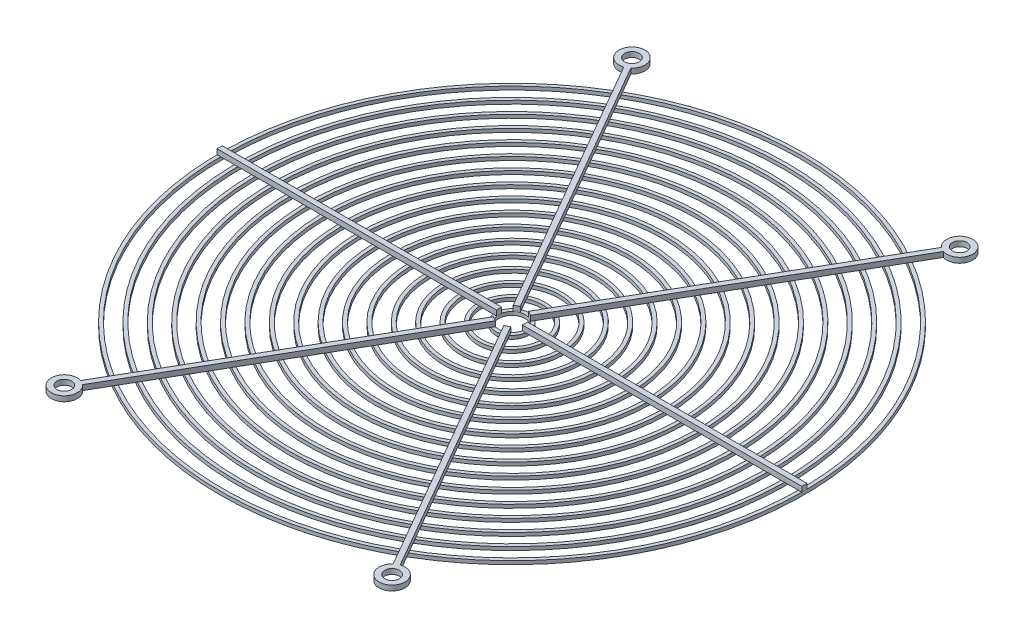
SolidWorks part; units mm, degrees
ref_plane "Plan de face" through (0, 0, 0) normal (0, 0, 1) x (1, 0, 0)
ref_plane "Plan de dessus" through (0, 0, 0) normal (0, 1, 0) x (1, 0, 0)
ref_plane "Plan de droite" through (0, 0, 0) normal (1, 0, 0) x (0, 0, -1)
ref_plane "Plan1" through (0, 2, 0) normal (0, 1, 0) x (-1, 0, 0)
sketch "Esquisse1" plane through (0, 0, 0) normal (0, 0, 1) x (1, 0, 0)
  line L0 (0, 0) -> (0, 38.6522) construction
  line L1 (19.5, 0) -> (19.5, 2)
  line L2 (7.5, 0) -> (9.5, 0)
  line L3 (7.5, 0) -> (7.5, 2)
  line L4 (7.5, 2) -> (9.5, 2)
  line L5 (9.5, 0) -> (9.5, 2)
  line L6 (17.5, 0) -> (19.5, 0)
  line L7 (17.5, 2) -> (19.5, 2)
  line L8 (17.5, 0) -> (17.5, 2)
  line L9 (29.5, 0) -> (29.5, 2)
  line L10 (27.5, 0) -> (29.5, 0)
  line L11 (27.5, 2) -> (29.5, 2)
  line L12 (27.5, 0) -> (27.5, 2)
  line L13 (39.5, 0) -> (39.5, 2)
  line L14 (37.5, 0) -> (39.5, 0)
  line L15 (37.5, 2) -> (39.5, 2)
  line L16 (37.5, 0) -> (37.5, 2)
  line L17 (49.5, 0) -> (49.5, 2)
  line L18 (47.5, 0) -> (49.5, 0)
  line L19 (47.5, 2) -> (49.5, 2)
  line L20 (47.5, 0) -> (47.5, 2)
  line L21 (59.5, 0) -> (59.5, 2)
  line L22 (57.5, 0) -> (59.5, 0)
  line L23 (57.5, 2) -> (59.5, 2)
  line L24 (57.5, 0) -> (57.5, 2)
  line L25 (69.5, 0) -> (69.5, 2)
  line L26 (67.5, 0) -> (69.5, 0)
  line L27 (67.5, 2) -> (69.5, 2)
  line L28 (67.5, 0) -> (67.5, 2)
  line L29 (79.5, 0) -> (79.5, 2)
  line L30 (77.5, 0) -> (79.5, 0)
  line L31 (77.5, 2) -> (79.5, 2)
  line L32 (77.5, 0) -> (77.5, 2)
  line L33 (89.5, 0) -> (89.5, 2)
  line L34 (87.5, 0) -> (89.5, 0)
  line L35 (87.5, 2) -> (89.5, 2)
  line L36 (87.5, 0) -> (87.5, 2)
  line L37 (99.5, 0) -> (99.5, 2)
  line L38 (97.5, 0) -> (99.5, 0)
  line L39 (97.5, 2) -> (99.5, 2)
  line L40 (97.5, 0) -> (97.5, 2)
  line L41 (109.5, 0) -> (109.5, 2)
  line L42 (107.5, 0) -> (109.5, 0)
  line L43 (107.5, 2) -> (109.5, 2)
  line L44 (107.5, 0) -> (107.5, 2)
  line L45 (119.5, 0) -> (119.5, 2)
  line L46 (117.5, 0) -> (119.5, 0)
  line L47 (117.5, 2) -> (119.5, 2)
  line L48 (117.5, 0) -> (117.5, 2)
  line L49 (129.5, 0) -> (129.5, 2)
  line L50 (127.5, 0) -> (129.5, 0)
  line L51 (127.5, 2) -> (129.5, 2)
  line L52 (127.5, 0) -> (127.5, 2)
  line L53 (139.5, 0) -> (139.5, 2)
  line L54 (137.5, 0) -> (139.5, 0)
  line L55 (137.5, 2) -> (139.5, 2)
  line L56 (137.5, 0) -> (137.5, 2)
  line L57 (149.5, 0) -> (149.5, 2)
  line L58 (147.5, 0) -> (149.5, 0)
  line L59 (147.5, 2) -> (149.5, 2)
  line L60 (147.5, 0) -> (147.5, 2)
  line L61 (159.5, 0) -> (159.5, 2)
  line L62 (157.5, 0) -> (159.5, 0)
  line L63 (157.5, 2) -> (159.5, 2)
  line L64 (157.5, 0) -> (157.5, 2)
  line L65 (169.5, 0) -> (169.5, 2)
  line L66 (167.5, 0) -> (169.5, 0)
  line L67 (167.5, 2) -> (169.5, 2)
  line L68 (167.5, 0) -> (167.5, 2)
  dimension "D2" = 2
  dimension "D3" = 2
revolve "Révolution1" add sketch "Esquisse1" angle 360 about L0
sketch "Esquisse2" plane through (0, 2, 0) normal (0, 1, 0) x (1, 0, 0)
  line L1 (7.5, 1.5) -> (182.6515, 1.5)
  line L2 (7.5, 1.5) -> (7.5, -1.5)
  line L3 (7.5, -1.5) -> (182.6515, -1.5)
  arc A0 (182.6515, -1.5) -> (182.6515, 1.5) centre (190, 0) ccw
  circle A1 centre (190, 0) radius 4.25
  dimension "D4" = 3
  dimension "D2" = 7.5
  dimension "D5" = 190
  dimension "D1" = 8.5
  dimension "D3" = 7.5
  dimension "D6" = 1.5
extrude "Extrusion2" add sketch "Esquisse2" along normal blind 3 separate body
pattern_circular "Répétition circulaire2" count 6 over 360 about axis through (0, 0, 0) along (0, 1, 0)
sketch "Esquisse4" plane through (0, 2, 0) normal (0, -1, 0) x (1, 0, 0)
  line L1 (169.5, 1.5) -> (169.5, -1.5)
  line L3 (-7.5, -1.5) -> (-7.5, 1.5)
  line L4 (-7.5, 1.5) -> (-182.6515, 1.5)
  line L5 (-182.6515, -1.5) -> (-7.5, -1.5)
  line L6 (7.5, 1.5) -> (7.5, -1.5)
  line L7 (-169.4934, 1.5) -> (-182.6515, 1.5)
  line L8 (-182.6515, -1.5) -> (-169.4934, -1.5)
  line L9 (7.5, -1.5) -> (182.6515, -1.5)
  line L10 (182.6515, 1.5) -> (7.5, 1.5)
  line L12 (169.5, -1.5) -> (182.6515, -1.5)
  line L13 (182.6515, 1.5) -> (169.5, 1.5)
  circle A0 centre (0, 0) radius 169.5 construction
  arc A1 (-182.6515, 1.5) -> (-182.6515, -1.5) centre (-190, 0) ccw
  arc A2 (-182.6515, 1.5) -> (-182.6515, -1.5) centre (-190, 0) ccw
  arc A3 (-169.4934, 1.5) -> (-169.4934, -1.5) centre (0, 0) ccw
  arc A5 (182.6515, -1.5) -> (182.6515, 1.5) centre (190, 0) ccw
  arc A6 (182.6515, -1.5) -> (182.6515, 1.5) centre (190, 0) ccw
  dimension "D1" = 0
  dimension "D2" = 0
extrude "Enlèv. mat.-Extru.3" cut sketch "Esquisse4" against normal blind 10
